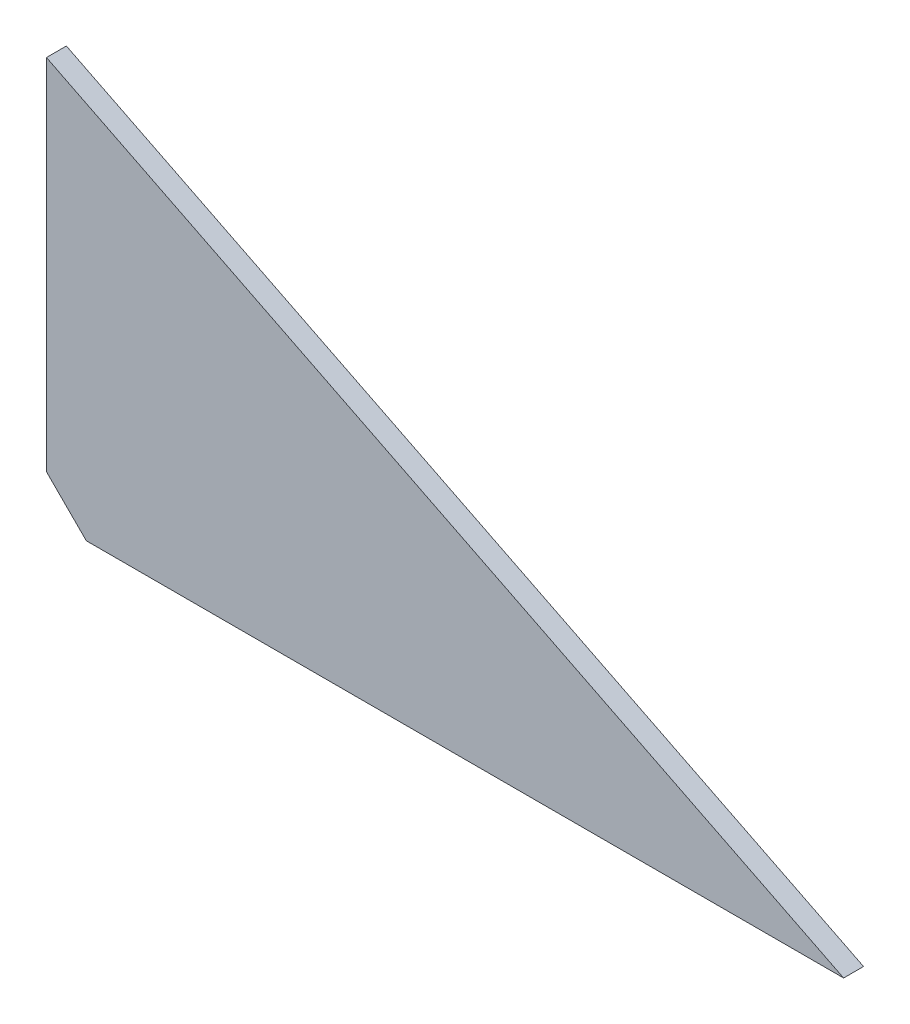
SolidWorks part; units mm, degrees
ref_plane "Plan de face" through (0, 0, 0) normal (0, 0, 1) x (1, 0, 0)
ref_plane "Plan de dessus" through (0, 0, 0) normal (0, 1, 0) x (1, 0, 0)
ref_plane "Plan de droite" through (0, 0, 0) normal (1, 0, 0) x (0, 0, -1)
sketch "Esquisse1" plane through (0, 0, 0) normal (0, 0, 1) x (1, 0, 0)
  line L0 (0, 100) -> (200, 0)
  line L2 (0, 100) -> (0, 0)
  line L3 (0, 0) -> (200, 0)
  dimension "D1" = 200
  dimension "D2" = 100
extrude "Boss.-Extru.1" add sketch "Esquisse1" along normal mid plane 5
chamfer "Chanfrein1" distance 10 angle 45 1 edges at (0, 0, 0)
